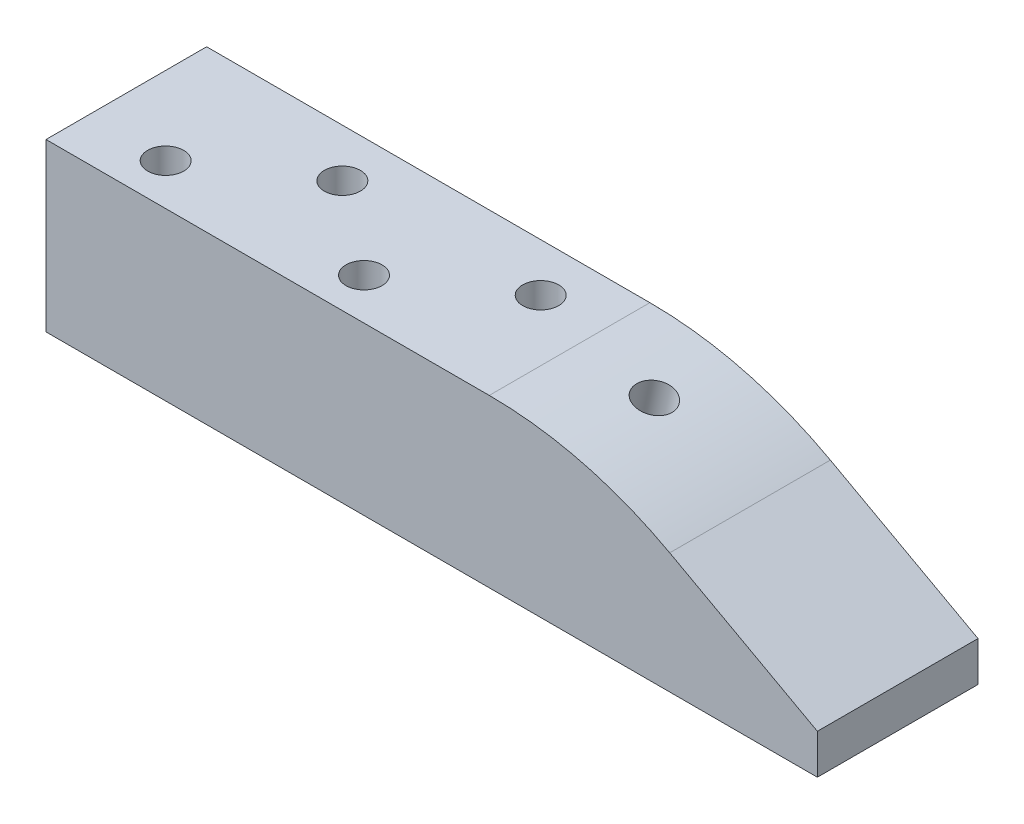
SolidWorks part; units mm, degrees
ref_plane "Front" through (0, 0, 0) normal (0, 0, 1) x (1, 0, 0)
ref_plane "Top" through (0, 0, 0) normal (0, 1, 0) x (1, 0, 0)
ref_plane "Right" through (0, 0, 0) normal (1, 0, 0) x (0, 0, -1)
sketch "Sketch1" plane through (0, 0, 0) normal (0, 1, 0) x (1, 0, 0)
  line L1 (-178.6601, 43.2878) -> (67.1769, 43.2878)
  line L2 (-178.6601, 43.2878) -> (-178.6601, -45.8024)
  line L3 (-178.6601, -45.8024) -> (67.1769, -45.8024)
  line L4 (67.1769, 43.2878) -> (67.1769, -45.8024)
extrude "Extrude1" add sketch "Sketch1" along normal blind 92.4224
other "Hole1" parameters "D1"=40
sketch "1" plane through (0, 92.4224, 0) normal (0, 1, 0) x (-1, 0, 0)
  circle A0 centre (25.2792, 22.8148) radius 10
  dimension "D1" = 20
sketch "4" plane through (58.6172, 92.4224, -39.3741) normal (0, 1, 0) x (-1, 0, 0)
  circle A0 centre (25.2792, 22.8148) radius 10
  dimension "D1" = 20
other "Hole2" parameters "D1"=40
sketch "Sketch6" plane through (0, 0, 45.8024) normal (0, 0, 1) x (1, 0, 0)
  line L0 (67.1769, 0) -> (67.1769, 92.4224)
  line L1 (167.2609, 66.8503) -> (249.1448, 22.084)
  line L2 (249.1448, 22.084) -> (249.1448, 0)
  line L3 (249.1448, 0) -> (67.1769, 0)
  arc A0 (67.1769, 92.4224) -> (167.2609, 66.8503) centre (67.1769, -116.2175) cw
extrude "Extrude2" add sketch "Sketch6" against normal up to vertex
hole_wizard "M20.0 (20) Diameter Hole1" positions "3DSketch1" profile "Sketch7" hole size "M20.0" standard "Ansi Metric"
sketch3d "3DSketch1"
  point P0 (109.6751, 88.0483, -3.2932)
sketch "Sketch7" plane through (109.6751, 88.0483, -3.2932) normal (0, 0, 1) x (-0.979, 0.2037, 0)
  line L0 (0, 0) -> (0, 144.9339)
  line L1 (0, 144.9339) -> (10, 144.9339)
  line L2 (10, 144.9339) -> (10, 0)
  line L5 (10, 0) -> (0, 0)
  line L11 (0, -6.35) -> (0, 107.95) construction
  dimension "Thru Hole Dia." = 20
  dimension "Thru Hole Depth" = 144.9339
pattern_linear "LPattern1" count 2 spacing 110 along (-1, 0, 0) of "Hole1", "Hole2"
